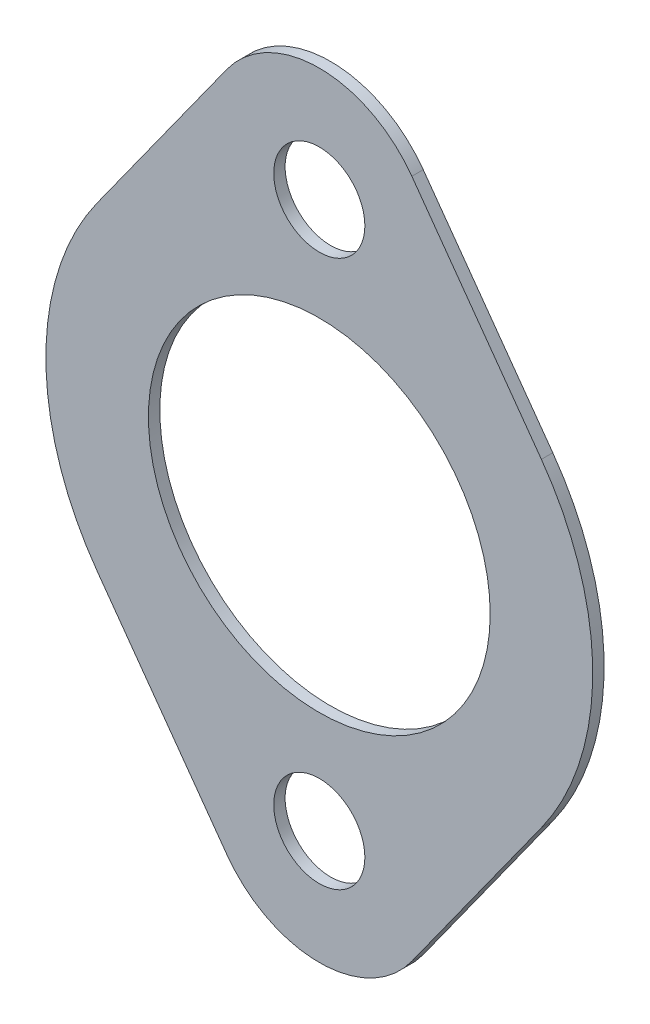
SolidWorks part; units mm, degrees
ref_plane "Front" through (0, 0, 0) normal (0, 0, 1) x (1, 0, 0)
ref_plane "Top" through (0, 0, 0) normal (0, 1, 0) x (1, 0, 0)
ref_plane "Right" through (0, 0, 0) normal (1, 0, 0) x (0, 0, -1)
sketch "Sketch1" plane through (0, 0, 0) normal (0, 0, 1) x (1, 0, 0)
  line L0 (0, 0) -> (0, 94.4945) construction
  line L1 (0, 0) -> (88.837, 0) construction
  line L2 (12.8942, 47.3604) -> (30.9461, 22.225)
  line L3 (12.8942, -47.3604) -> (30.9461, -22.225)
  line L4 (-12.8942, 47.3604) -> (-30.9461, 22.225)
  line L5 (-12.8942, -47.3604) -> (-30.9461, -22.225)
  arc A0 (-12.8942, 47.3604) -> (12.8942, 47.3604) centre (0, 38.1) cw
  arc A1 (-12.8942, -47.3604) -> (12.8942, -47.3604) centre (0, -38.1) ccw
  arc A2 (30.9461, 22.225) -> (30.9461, -22.225) centre (0, 0) cw
  arc A3 (-30.9461, -22.225) -> (-30.9461, 22.225) centre (0, 0) cw
  dimension "EndR" = 15.875
  dimension "SideR" = 38.1
  dimension "CtoC" = 76.2
extrude "Main" add sketch "Sketch1" along normal blind 1.5875
sketch "Sketch2" plane through (0, 0, 1.5875) normal (0, 0, 1) x (1, 0, 0)
  circle A0 centre (0, 38.1) radius 6.35
  circle A1 centre (0, -38.1) radius 6.35
  circle A2 centre (0, 0) radius 23.8125
  dimension "BoltH" = 12.7
  dimension "CenterH" = 47.625
extrude "Holes" cut sketch "Sketch2" against normal through all
